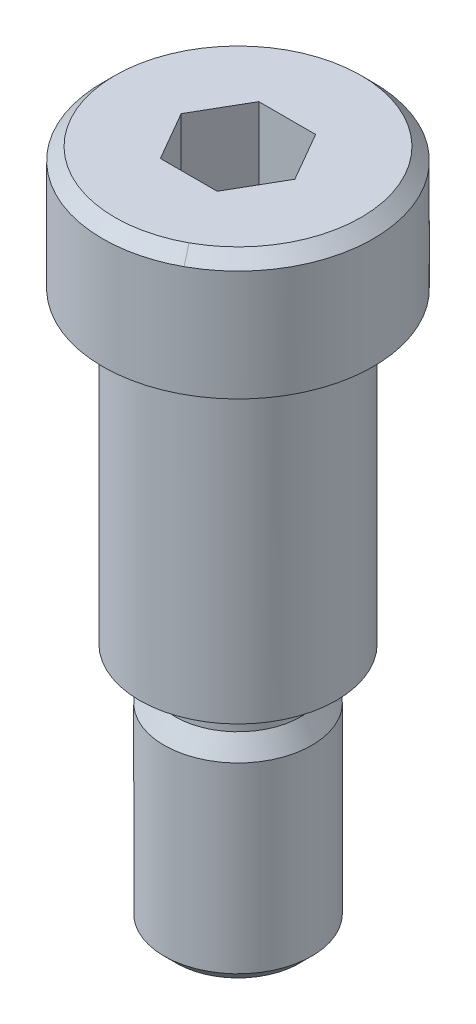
SolidWorks part; units mm, degrees
ref_plane "Plan de face" through (0, 0, 0) normal (0, 0, 1) x (1, 0, 0)
ref_plane "Plan de dessus" through (0, 0, 0) normal (0, 1, 0) x (1, 0, 0)
ref_plane "Plan de droite" through (0, 0, 0) normal (1, 0, 0) x (0, 0, -1)
imported_body "Importée1"
sketch "Esquisse1" plane through (0, 0, 0) normal (0, 1, 0) x (-1, 0, 0)
  line L1 (-4.6188, 0) -> (-2.3094, -4)
  line L2 (-2.3094, -4) -> (2.3094, -4)
  line L3 (2.3094, -4) -> (4.6188, 0)
  line L4 (4.6188, 0) -> (2.3094, 4)
  line L5 (2.3094, 4) -> (-2.3094, 4)
  line L6 (-2.3094, 4) -> (-4.6188, 0)
  circle A0 centre (0, 0) radius 4 construction
extrude "Enlèv. mat.-Extru.1" cut sketch "Esquisse1" against normal blind 6
